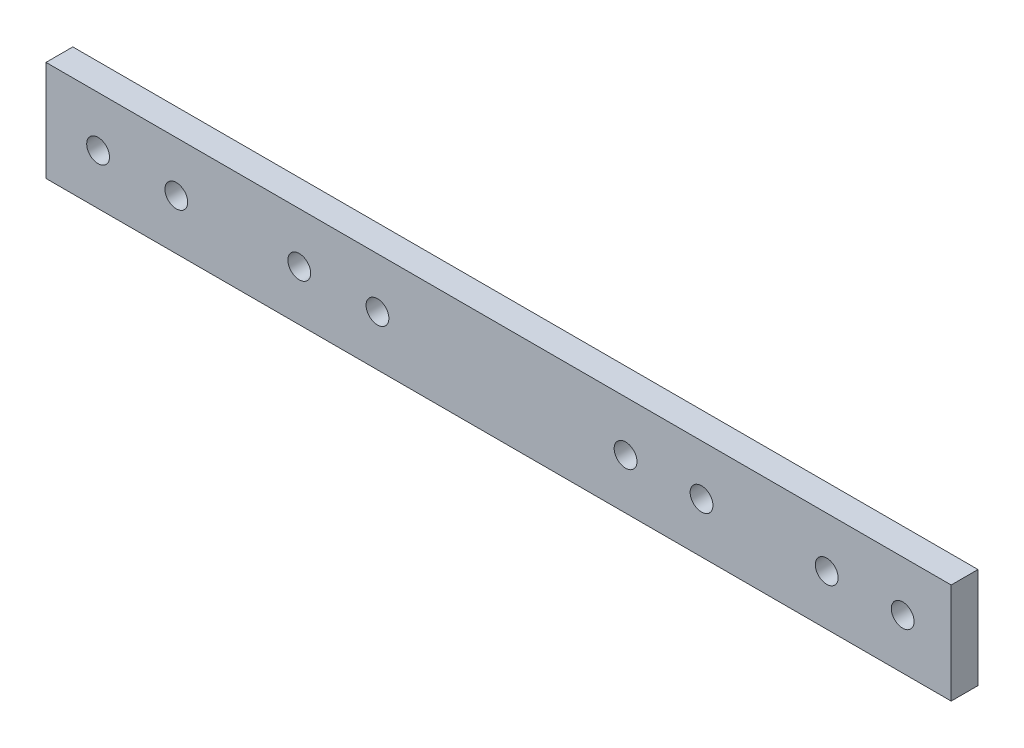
SolidWorks part; units mm, degrees
ref_plane "Plan_Face" through (0, 0, 0) normal (0, 0, 1) x (1, 0, 0)
ref_plane "Plan_Dessus" through (0, 0, 0) normal (0, 1, 0) x (1, 0, 0)
ref_plane "Plan_Droite" through (0, 0, 0) normal (1, 0, 0) x (0, 0, -1)
sketch "Esquisse1" plane through (0, 0, 0) normal (0, 0, 1) x (1, 0, 0)
  line L1 (-135, 15) -> (135, 15)
  line L2 (-135, 15) -> (-135, -15)
  line L3 (-135, -15) -> (135, -15)
  line L4 (135, 15) -> (135, -15)
  line L5 (-135, 15) -> (135, -15) construction
  line L6 (-135, -15) -> (135, 15) construction
  point P0 (0, 0)
  dimension "D1" = 270
  dimension "D2" = 30
extrude "Extrusion1" add sketch "Esquisse1" along normal blind 8
hole_wizard "Trou taraudé M81" positions "Esquisse3D1" profile "Esquisse2" tap size "M8" standard "ISO"
sketch3d "Esquisse3D1"
  line L0 (0, 0, 0) -> (0, 75.026, 0) construction
  line L2 (-135, -15, 8) -> (135, -15, 8) construction
  point P0 (-119.4643, 0, 8)
  point P2 (-96.1248, 0, 8)
  point P4 (-59.4643, 0, 8)
  point P6 (-36.1248, 0, 8)
  point P8 (37.8752, 0, 8)
  point P10 (60.5357, 0, 8)
  point P12 (97.8752, 0, 8)
  point P14 (120.5357, 0, 8)
  dimension "D1" = 74
  dimension "D2" = 60
  dimension "D3" = 60
  dimension "D4" = 120
  dimension "D5" = 60
  dimension "D6" = 60
  dimension "D7" = 37
  dimension "D8" = 15
  dimension "D9" = 60
sketch "Esquisse2" plane through (-119.4643, 0, 8) normal (1, 0, 0) x (0, -1, 0)
  line L0 (0, 0) -> (0, 8)
  line L1 (0, 8) -> (3.4, 8)
  line L2 (3.4, 8) -> (3.4, 0)
  line L5 (3.4, 0) -> (0, 0)
  line L11 (0, -6.35) -> (0, 107.95) construction
  dimension "Diamètre du trou pour taraudage jusqu'au prochain" = 6.8
  dimension "Profondeur du trou pour taraudage jusqu'au prochain" = 8
